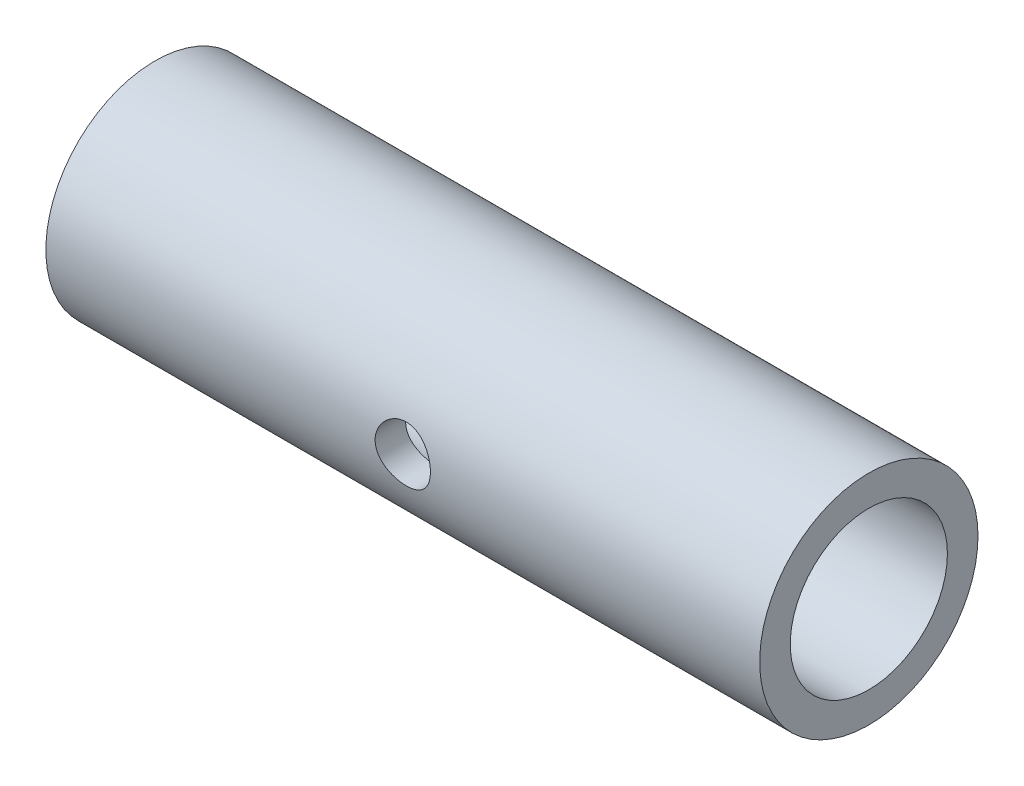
SolidWorks part; units mm, degrees
ref_plane "Front Plane" through (0, 0, 0) normal (0, 0, 1) x (1, 0, 0)
ref_plane "Top Plane" through (0, 0, 0) normal (0, 1, 0) x (1, 0, 0)
ref_plane "Right Plane" through (0, 0, 0) normal (1, 0, 0) x (0, 0, -1)
sketch "Sketch1" plane through (0, 0, 0) normal (1, 0, 0) x (0, 0, -1)
  circle A0 centre (0, 0) radius 9.525
  circle A1 centre (0, 0) radius 6.858
  dimension "D1" = 19.05
  dimension "D2" = 13.716
extrude "Extrude1" add sketch "Sketch1" along normal mid plane 62.2808
sketch "Sketch2" plane through (0, 0, 0) normal (0, 0, 1) x (1, 0, 0)
  circle A0 centre (0, 0) radius 2.413
  dimension "D1" = 4.826
extrude "Cut-Extrude1" cut sketch "Sketch2" against normal through all and the other way through all
